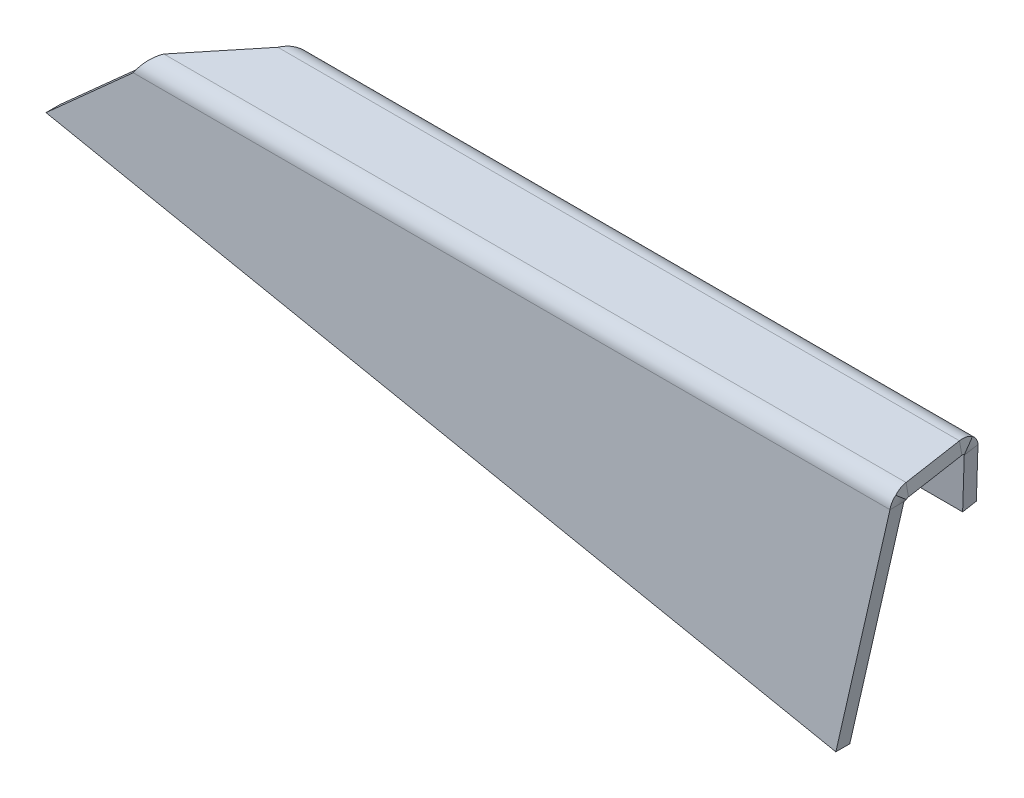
SolidWorks part; units mm, degrees
ref_plane "前视基准面" through (0, 0, 0) normal (0, 0, 1) x (1, 0, 0)
ref_plane "上视基准面" through (0, 0, 0) normal (0, 1, 0) x (1, 0, 0)
ref_plane "右视基准面" through (0, 0, 0) normal (1, 0, 0) x (0, 0, -1)
sketch "草图1" plane through (0, 0, 0) normal (0, 0, 1) x (1, 0, 0)
  line L0 (0, 40) -> (-8, 80)
  line L3 (-341, 80) -> (-8, 80)
  line L4 (0, 0) -> (0, 40)
  line L5 (-485, -49) -> (-32, -140)
  line L7 (0, 0) -> (-32, -140)
  line L8 (-485, -49) -> (-341, 80)
  point P7 (0, 80)
  dimension "D1" = 485
  dimension "D4" = 80
  dimension "D5" = 341
  dimension "D2" = 140
  dimension "D3" = 40
  dimension "D6" = 8
  dimension "D7" = 32
  dimension "D8" = 91
sheet metal parameters "钣金1" thickness 8 parameters "D1"=2
base flange "基体-法兰1" sketch "草图1" thickness 8 reverse thickness direction yes parameters "D1"=2
sketch "草图3" plane through (0, 0, 0) normal (0, 0, -1) x (-1, 0, 0)
  line L2 (8, 0) -> (341, 0)
  line L3 (8, 0) -> (341, 0)
  dimension "D1" = 80
sketched bend "绘制的折弯1" parameters "D1"=2
bend "草图折弯1" bend radius 2 bend angle 80 parameters "D5"=1
sketch "草图4" plane through (0, -2.4349, -0.4293) normal (0, -0.9848, -0.1736) x (1, 0, 0)
  line L2 (-8, -37.0534) -> (-341, -37.0534)
  line L3 (-8, -37.0534) -> (-341, -37.0534)
  dimension "D1" = 40
sketched bend "绘制的折弯2" parameters "D1"=2
bend "草图折弯2" bend radius 2 bend angle 90 parameters "D5"=2
flat pattern "平板型式1"
sketch "折弯-线1" plane through (0, 0, 0) normal (0, 1, 0) x (-1, 0, 0)
bend of the flat pattern "展开-<草图折弯1>1"
bend of the flat pattern "展开-<草图折弯2>1"
